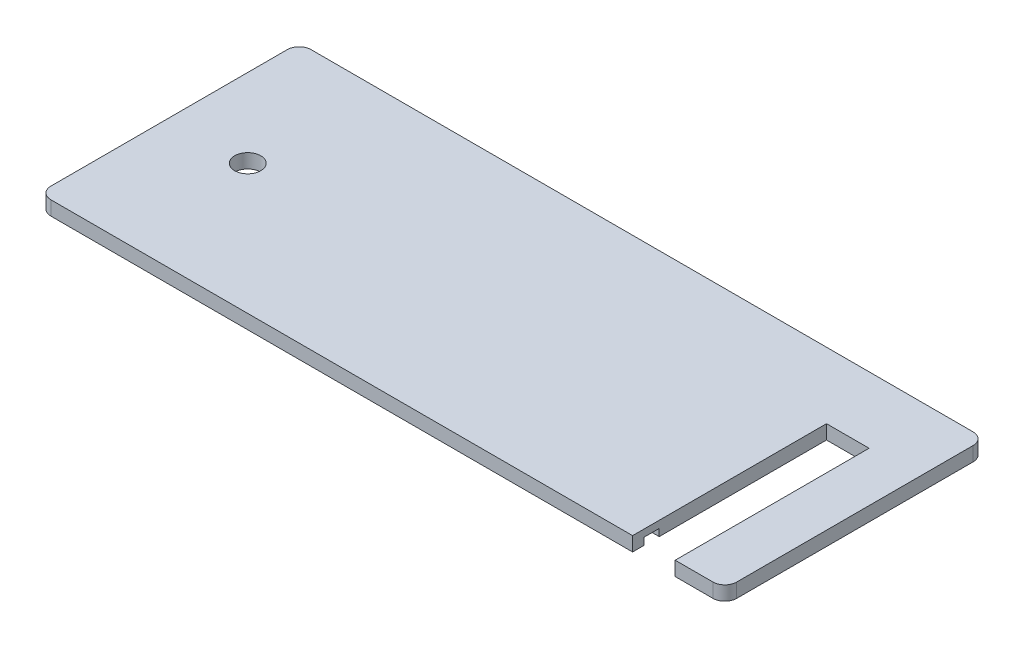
SolidWorks part; units mm, degrees
ref_plane "Plan de face" through (0, 0, 0) normal (0, 0, 1) x (1, 0, 0)
ref_plane "Plan de dessus" through (0, 0, 0) normal (0, 1, 0) x (1, 0, 0)
ref_plane "Plan de droite" through (0, 0, 0) normal (1, 0, 0) x (0, 0, -1)
sketch "Esquisse1" plane through (0, 0, 0) normal (0, 1, 0) x (1, 0, 0)
  line L0 (269, 0) -> (285, 0)
  line L1 (5, 0) -> (251, 0)
  line L2 (0, 5) -> (0, 105)
  line L3 (5, 110) -> (285, 110)
  line L4 (290, 5) -> (290, 105)
  line L5 (-13.5867, 55) -> (90.4191, 55) construction
  line L6 (251, 0) -> (251, 82)
  line L7 (251, 82) -> (269, 82)
  line L8 (269, 0) -> (269, 82)
  line L9 (11.25, 46.8613) -> (11.25, 83.4095) construction
  line L10 (33.25, 46.8613) -> (33.25, 83.4095) construction
  arc A0 (0, 105) -> (5, 110) centre (5, 105) cw
  arc A1 (5, 0) -> (0, 5) centre (5, 5) cw
  arc A2 (285, 0) -> (290, 5) centre (285, 5) ccw
  arc A3 (285, 110) -> (290, 105) centre (285, 105) cw
  circle A4 centre (33.25, 55) radius 5.5
  point P13 (0, 0)
  dimension "D4" = 5
  dimension "D1" = 251
  dimension "D2" = 18
  dimension "D3" = 28
  dimension "D5" = 11.25
  dimension "D6" = 22
extrude "Boss.-Extru.1" add sketch "Esquisse1" along normal blind 6
sketch "Esquisse2" plane through (0, 0, 0) normal (0, -1, 0) x (1, 0, 0)
  line L0 (0, -105) -> (0, -5) construction
  line L1 (8, -86.913) -> (8, -103.6438) construction
  line L2 (4.75, -102.9873) -> (4.75, -7.0127)
  line L3 (7.0127, -4.75) -> (282.9873, -4.75)
  line L4 (285.25, -102.9873) -> (285.25, -7.0127)
  line L5 (285, -110) -> (5, -110) construction
  line L6 (290, -5) -> (290, -105) construction
  line L7 (5, 0) -> (251, 0) construction
  line L8 (4.75, -105.25) -> (27.3039, -82.6961) construction
  line L9 (-14.6897, -55) -> (195.8406, -55) construction
  line L10 (145, 36.1445) -> (145, -64.4818) construction
  line L11 (33.25, -71.2963) -> (33.25, -36.4189) construction
  line L12 (312.858, -102) -> (160.8292, -102) construction
  line L13 (7.0127, -105.25) -> (8.9873, -105.25)
  line L14 (11.25, -102.9873) -> (11.25, -102)
  line L15 (11.25, -11.25) -> (278.75, -11.25)
  line L16 (278.75, -98.8) -> (278.75, -11.25)
  line L17 (312.858, -98.8) -> (195.8406, -98.8) construction
  line L18 (281.0127, -105.25) -> (282.9873, -105.25)
  line L19 (278.75, -102.9873) -> (278.75, -102)
  line L20 (278.75, -102) -> (11.25, -102)
  line L21 (278.75, -98.8) -> (11.25, -98.8)
  line L22 (11.25, -98.8) -> (11.25, -11.25)
  arc A0 (4.75, -102.9873) -> (7.0127, -105.25) centre (5.8814, -104.1186) ccw
  arc A1 (4.75, -7.0127) -> (7.0127, -4.75) centre (5.8814, -5.8814) cw
  arc A2 (285.25, -7.0127) -> (282.9873, -4.75) centre (284.1186, -5.8814) ccw
  arc A3 (285.25, -102.9873) -> (282.9873, -105.25) centre (284.1186, -104.1186) cw
  arc A4 (11.25, -102.9873) -> (8.9873, -105.25) centre (10.1186, -104.1186) cw
  arc A5 (278.75, -102.9873) -> (281.0127, -105.25) centre (279.8814, -104.1186) ccw
  dimension "D6" = 55
  dimension "D2" = 3.25
  dimension "D1" = 4.75
  dimension "D3" = 4.75
  dimension "D4" = 4.75
  dimension "D5" = 8
  dimension "D7" = 3.2
  dimension "D9" = 6.5
  dimension "D11" = 6.5
extrude "Enlèv. mat.-Extru.1" cut sketch "Esquisse2" against normal blind 3
sketch "Esquisse4" plane through (0, 0, 0) normal (0, -1, 0) x (1, 0, 0)
  line L0 (23.7099, -55) -> (102.1203, -55) construction
  line L1 (33.25, -67.998) -> (33.25, -30.7845) construction
  line L2 (41.25, -30.7845) -> (41.25, -67.998) construction
  line L3 (37.1277, -44) -> (102.1203, -44) construction
  line L4 (87.25, -30.7845) -> (87.25, -67.998) construction
  circle A0 centre (41.25, -44) radius 1.1
  circle A1 centre (87.25, -44) radius 1.1
  circle A2 centre (87.25, -66) radius 1.1
  circle A3 centre (41.25, -66) radius 1.1
  dimension "D1" = 8
  dimension "D2" = 46
  dimension "D3" = 11
extrude "Enlèv. mat.-Extru.2" cut sketch "Esquisse4" against normal blind 1
sketch "Esquisse5" plane through (0, 0, 0) normal (0, -1, 0) x (1, 0, 0)
  line L0 (251, 14.5553) -> (251, -33.9309) construction
  line L2 (235, 14.5553) -> (235, -33.9309) construction
  line L3 (262.6503, 0) -> (222.476, 0) construction
  line L4 (5, 0) -> (251, 0) construction
  line L5 (262.6503, -7.75) -> (222.476, -7.75) construction
  line L6 (-7.5021, -55) -> (15.2916, -55) construction
  line L7 (8.25, -43.9507) -> (8.25, -58.8232) construction
  line L8 (11.25, -102) -> (11.25, -102.9873) construction
  line L9 (251, -11.25) -> (251, -82) construction
  circle A0 centre (235, -7.75) radius 6
  circle A1 centre (8.25, -55) radius 6
  dimension "D3" = 3
  dimension "D1" = 7.75
  dimension "D2" = 16
extrude "Enlèv. mat.-Extru.3" cut sketch "Esquisse5" against normal blind 3.5
